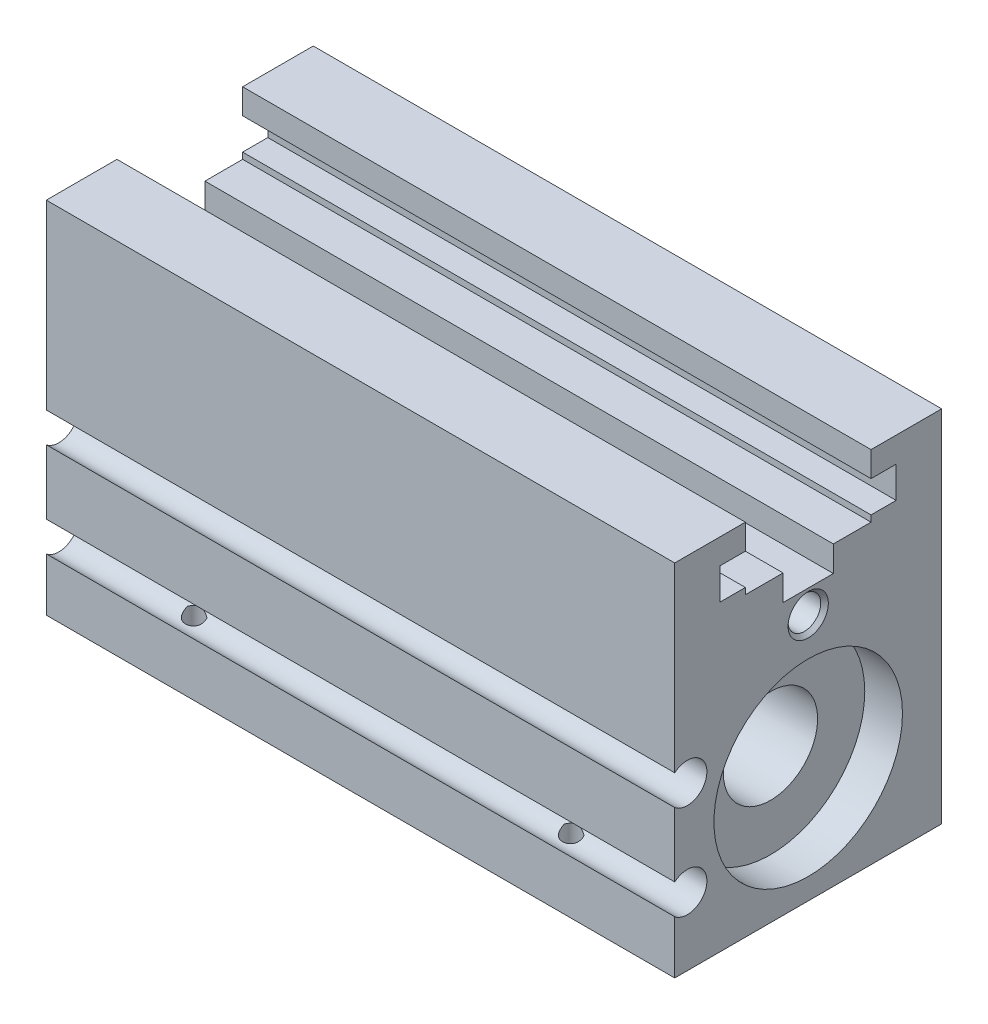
SolidWorks part; units mm, degrees
ref_plane "Front Plane" through (0, 0, 0) normal (0, 0, 1) x (1, 0, 0)
ref_plane "Top Plane" through (0, 0, 0) normal (0, 1, 0) x (1, 0, 0)
ref_plane "Right Plane" through (0, 0, 0) normal (1, 0, 0) x (0, 0, -1)
sketch "Sketch1" plane through (0, 0, 0) normal (1, 0, 0) x (0, 0, -1)
  line L0 (-13.4874, -18.161) -> (13.4874, -18.161)
  line L1 (13.4874, -18.161) -> (13.4874, 18.161)
  line L2 (13.4874, 18.161) -> (6.35, 18.161)
  line L3 (6.35, 18.161) -> (6.35, 15.621)
  line L4 (6.35, 15.621) -> (8.89, 15.621)
  line L5 (8.89, 15.621) -> (8.89, 12.446)
  line L6 (8.89, 12.446) -> (6.35, 12.446)
  line L7 (6.35, 12.446) -> (6.35, 11.811)
  line L8 (6.35, 11.811) -> (2.54, 11.811)
  line L9 (2.54, 11.811) -> (2.54, 9.2202)
  line L10 (2.54, 9.2202) -> (-2.54, 9.2202)
  line L11 (-2.54, 9.2202) -> (-2.54, 11.811)
  line L12 (-2.54, 11.811) -> (-6.35, 11.811)
  line L13 (-6.35, 11.811) -> (-6.35, 12.446)
  line L14 (-6.35, 12.446) -> (-8.89, 12.446)
  line L15 (-8.89, 12.446) -> (-8.89, 15.621)
  line L16 (-8.89, 15.621) -> (-6.35, 15.621)
  line L17 (-6.35, 15.621) -> (-6.35, 18.161)
  line L18 (-6.35, 18.161) -> (-13.4874, 18.161)
  line L19 (-13.4874, 18.161) -> (-13.4874, -0.2066)
  line L20 (-13.4874, -3.2478) -> (-13.4874, -9.757)
  line L21 (-13.4874, -12.7982) -> (-13.4874, -18.161)
  arc A0 (-13.4874, -0.2066) -> (-13.4874, -3.2478) centre (-12.2174, -1.7272) cw
  arc A1 (-13.4874, -9.757) -> (-13.4874, -12.7982) centre (-12.2174, -11.2776) cw
extrude "Extrude1" add sketch "Sketch1" along normal blind 63.5
ref_plane "Plane1" through (63.5, 0, 0) normal (1, 0, 0) x (0, 0, -1)
sketch "Sketch2" plane through (63.5, 0, 0) normal (1, 0, 0) x (0, 0, -1)
  circle A0 centre (0, -6.5024) radius 9.525
extrude "Cut-Extrude1" cut sketch "Sketch2" against normal blind 3.81
sketch "Sketch3" plane through (0, 0, 0) normal (1, 0, 0) x (0, 0, -1)
  circle A0 centre (10.3251, 8.4582) radius 1.2027
extrude "Cut-Extrude2" cut sketch "Sketch3" along normal blind 3.048
sketch "Sketch4" plane through (0, 0, 0) normal (1, 0, 0) x (0, 0, -1)
  circle A0 centre (-10.3251, -15.367) radius 1.2027
extrude "Cut-Extrude3" cut sketch "Sketch4" along normal blind 3.048
ref_plane "Plane2" through (0, 0, 10.3251) normal (0, 0, 1) x (1, 0, 0)
sketch "Sketch5" plane through (0, 0, 10.3251) normal (0, 0, 1) x (1, 0, 0)
  line L0 (0, 8.4582) -> (0, 9.8552)
  line L1 (0, 9.8552) -> (0.381, 9.4742)
  line L2 (0.381, 9.4742) -> (6.2714, 9.4742)
  line L3 (6.2714, 9.4742) -> (6.858, 8.4582)
  line L4 (6.858, 8.4582) -> (0, 8.4582)
  line L5 (6.858, 8.4582) -> (0, 8.4582) construction
revolve "Cut-Revolve1" cut sketch "Sketch5" angle 360 about L5
ref_plane "Plane3" through (0, 0, -10.3251) normal (0, 0, 1) x (1, 0, 0)
sketch "Sketch6" plane through (0, 0, -10.3251) normal (0, 0, 1) x (1, 0, 0)
  line L0 (0, -15.367) -> (0, -13.97)
  line L1 (0, -13.97) -> (0.381, -14.351)
  line L2 (0.381, -14.351) -> (6.2714, -14.351)
  line L3 (6.2714, -14.351) -> (6.858, -15.367)
  line L4 (6.858, -15.367) -> (0, -15.367)
  line L5 (6.858, -15.367) -> (0, -15.367) construction
revolve "Cut-Revolve2" cut sketch "Sketch6" angle 360 about L5
ref_plane "Plane4" through (5.715, 0, 0) normal (1, 0, 0) x (0, 0, -1)
sketch "Sketch7" plane through (5.715, 0, 0) normal (1, 0, 0) x (0, 0, -1)
  line L0 (8.9154, 3.8862) -> (8.9154, 5.8293)
  line L1 (8.9154, 5.8293) -> (13.0175, 5.8293)
  line L2 (13.0175, 5.8293) -> (13.4874, 6.2992)
  line L3 (13.4874, 6.2992) -> (13.4874, 3.8862)
  line L4 (13.4874, 3.8862) -> (8.9154, 3.8862)
  line L5 (13.4874, 3.8862) -> (8.9154, 3.8862) construction
revolve "Cut-Revolve3" cut sketch "Sketch7" angle 360 about L5
ref_plane "Plane5" through (54.61, 0, 0) normal (1, 0, 0) x (0, 0, -1)
sketch "Sketch8" plane through (54.61, 0, 0) normal (1, 0, 0) x (0, 0, -1)
  line L0 (8.9154, 3.8862) -> (8.9154, 5.8293)
  line L1 (8.9154, 5.8293) -> (13.0175, 5.8293)
  line L2 (13.0175, 5.8293) -> (13.4874, 6.2992)
  line L3 (13.4874, 6.2992) -> (13.4874, 3.8862)
  line L4 (13.4874, 3.8862) -> (8.9154, 3.8862)
  line L5 (13.4874, 3.8862) -> (8.9154, 3.8862) construction
revolve "Cut-Revolve4" cut sketch "Sketch8" angle 360 about L5
sketch "Sketch9" plane through (0, 0, 0) normal (1, 0, 0) x (0, 0, -1)
  circle A0 centre (0, -6.5024) radius 9.525
extrude "Cut-Extrude4" cut sketch "Sketch9" along normal blind 3.81
sketch "Sketch10" plane through (0, 0, 0) normal (0, 0, 1) x (1, 0, 0)
  line L0 (0, -6.5024) -> (0, 2.8321)
  line L1 (0, 2.8321) -> (3.81, 2.8321)
  line L2 (3.81, 2.8321) -> (3.81, -6.5024)
  line L3 (3.81, -6.5024) -> (0, -6.5024)
  line L4 (3.81, -6.5024) -> (0, -6.5024) construction
revolve "Revolve1" add sketch "Sketch10" angle 360 about L4
ref_plane "Plane6" through (12.7, 0, 0) normal (1, 0, 0) x (0, 0, -1)
sketch "Sketch11" plane through (12.7, 0, 0) normal (1, 0, 0) x (0, 0, -1)
  line L0 (-11.1125, -18.161) -> (-12.5095, -18.161)
  line L1 (-12.5095, -18.161) -> (-12.1285, -17.78)
  line L2 (-12.1285, -17.78) -> (-12.1285, -12.804)
  line L3 (-12.1285, -12.804) -> (-11.1125, -12.2174)
  line L4 (-11.1125, -12.2174) -> (-11.1125, -18.161)
  line L5 (-11.1125, -12.2174) -> (-11.1125, -18.161) construction
revolve "Cut-Revolve5" cut sketch "Sketch11" angle 360 about L5
ref_plane "Plane7" through (0, -18.161, 0) normal (0, 1, 0) x (-1, 0, 0)
ref_plane "Plane8" through (50.8, 0, 0) normal (1, 0, 0) x (0, 0, -1)
ref_plane "Plane9" through (50.8, 0, 0) normal (1, 0, 0) x (0, 0, -1)
ref_plane "Plane10" through (12.7, 0, 0) normal (1, 0, 0) x (0, 0, -1)
sketch "Sketch12" plane through (50.8, 0, 0) normal (1, 0, 0) x (0, 0, -1)
  line L0 (-11.1125, -18.161) -> (-12.5095, -18.161)
  line L1 (-12.5095, -18.161) -> (-12.1285, -17.78)
  line L2 (-12.1285, -17.78) -> (-12.1285, -12.804)
  line L3 (-12.1285, -12.804) -> (-11.1125, -12.2174)
  line L4 (-11.1125, -12.2174) -> (-11.1125, -18.161)
  line L5 (-11.1125, -12.2174) -> (-11.1125, -18.161) construction
sketch "Sketch13" plane through (50.8, 0, 0) normal (1, 0, 0) x (0, 0, -1)
  line L0 (11.1125, -18.161) -> (9.7155, -18.161)
  line L1 (9.7155, -18.161) -> (10.0965, -17.78)
  line L2 (10.0965, -17.78) -> (10.0965, -12.804)
  line L3 (10.0965, -12.804) -> (11.1125, -12.2174)
  line L4 (11.1125, -12.2174) -> (11.1125, -18.161)
  line L5 (11.1125, -12.2174) -> (11.1125, -18.161) construction
sketch "Sketch14" plane through (12.7, 0, 0) normal (1, 0, 0) x (0, 0, -1)
  line L0 (11.1125, -18.161) -> (9.7155, -18.161)
  line L1 (9.7155, -18.161) -> (10.0965, -17.78)
  line L2 (10.0965, -17.78) -> (10.0965, -12.804)
  line L3 (10.0965, -12.804) -> (11.1125, -12.2174)
  line L4 (11.1125, -12.2174) -> (11.1125, -18.161)
  line L5 (11.1125, -12.2174) -> (11.1125, -18.161) construction
revolve "Cut-Revolve6" cut sketch "Sketch12" angle 360 about L5
revolve "Cut-Revolve7" cut sketch "Sketch13" angle 360 about L5
revolve "Cut-Revolve8" cut sketch "Sketch14" angle 360 about L5
sketch "Sketch15" plane through (0, -18.161, 0) normal (0, 1, 0) x (-1, 0, 0)
  circle A0 centre (-19.05, 11.1125) radius 1.2027
extrude "Cut-Extrude5" cut sketch "Sketch15" along normal blind 3.175
sketch "Sketch16" plane through (0, -18.161, 0) normal (0, 1, 0) x (-1, 0, 0)
  circle A0 centre (-44.45, 11.1125) radius 1.2027
sketch "Sketch17" plane through (0, -18.161, 0) normal (0, 1, 0) x (-1, 0, 0)
  circle A0 centre (-44.45, -11.1125) radius 1.2027
sketch "Sketch18" plane through (0, -18.161, 0) normal (0, 1, 0) x (-1, 0, 0)
  circle A0 centre (-19.05, -11.1125) radius 1.2027
extrude "Cut-Extrude6" cut sketch "Sketch16" along normal blind 3.175
extrude "Cut-Extrude7" cut sketch "Sketch17" along normal blind 3.175
extrude "Cut-Extrude8" cut sketch "Sketch18" along normal blind 3.175
sketch "Sketch19" plane through (0, 0, 0) normal (0, 0, 1) x (1, 0, 0)
  line L0 (0, 5.3609) -> (0, 7.3929)
  line L1 (0, 7.3929) -> (0.381, 7.0119)
  line L2 (0.381, 7.0119) -> (3.048, 7.0119)
  line L3 (3.048, 7.0119) -> (3.048, 5.3609)
  line L4 (3.048, 5.3609) -> (0, 5.3609)
  line L5 (3.048, 5.3609) -> (0, 5.3609) construction
revolve "Cut-Revolve9" cut sketch "Sketch19" angle 360 about L5
sketch "Sketch20" plane through (0, 0, 0) normal (0, 0, 1) x (1, 0, 0)
  line L0 (8.89, -6.5024) -> (8.89, -1.7399)
  line L1 (8.89, -1.7399) -> (59.69, -1.7399)
  line L2 (59.69, -1.7399) -> (59.69, -6.5024)
  line L3 (59.69, -6.5024) -> (8.89, -6.5024)
  line L4 (59.69, -6.5024) -> (8.89, -6.5024) construction
revolve "Cut-Revolve10" cut sketch "Sketch20" angle 360 about L4
sketch "Sketch21" plane through (0, 0, 0) normal (0, 0, 1) x (1, 0, 0)
  line L0 (60.452, 6.8834) -> (60.452, 8.5344)
  line L1 (60.452, 8.5344) -> (63.119, 8.5344)
  line L2 (63.119, 8.5344) -> (63.5, 8.9154)
  line L3 (63.5, 8.9154) -> (63.5, 6.8834)
  line L4 (63.5, 6.8834) -> (60.452, 6.8834)
  line L5 (63.5, 6.8834) -> (60.452, 6.8834) construction
revolve "Cut-Revolve11" cut sketch "Sketch21" angle 360 about L5
ref_plane "Plane11" through (63.5025, 0, 0) normal (1, 0, 0) x (0, 0, -1)
ref_plane "Plane12" through (63.5, 0, 0) normal (1, 0, 0) x (0, 0, -1)
ref_plane "Plane13" through (25.5016, 0, 0) normal (1, 0, 0) x (0, 0, -1)
